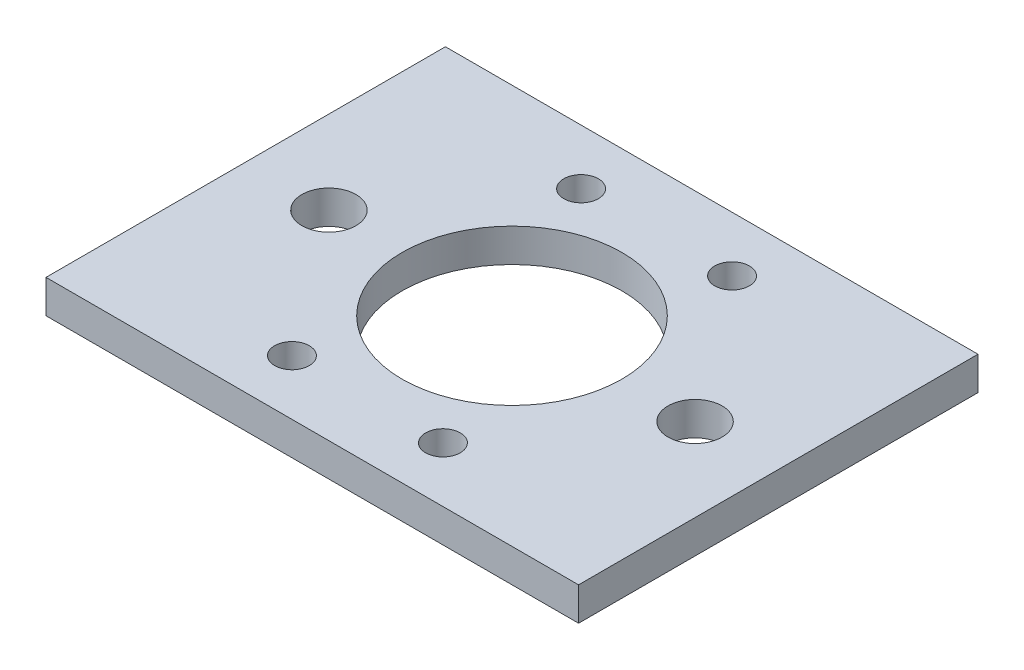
SolidWorks part; units mm, degrees
ref_plane "Front Plane" through (0, 0, 0) normal (0, 0, 1) x (1, 0, 0)
ref_plane "Top Plane" through (0, 0, 0) normal (0, 1, 0) x (1, 0, 0)
ref_plane "Right Plane" through (0, 0, 0) normal (1, 0, 0) x (0, 0, -1)
sketch "Sketch1" plane through (0, 0, 0) normal (0, 1, 0) x (1, 0, 0)
  line L1 (0, 0) -> (-203.2, 0)
  line L2 (0, 0) -> (0, -152.4)
  line L3 (0, -152.4) -> (-203.2, -152.4)
  line L4 (-203.2, 0) -> (-203.2, -152.4)
  dimension "D1" = 152.4
  dimension "D2" = 203.2
extrude "Extrude1" add sketch "Sketch1" along normal blind 12.7
sketch "Sketch2" plane through (0, 12.7, 0) normal (0, 1, 0) x (1, 0, 0)
  line L0 (0, -152.4) -> (0, 0) construction
  line L1 (0, 0) -> (-203.2, 0) construction
  circle A0 centre (-101.6, -76.2) radius 41.91
  dimension "D1" = 83.82
  dimension "D2" = 101.6
  dimension "D3" = 76.2
extrude "Cut-Extrude1" cut sketch "Sketch2" against normal blind 12.7
ref_point "Point1"
sketch "Sketch3" plane through (0, 12.7, 0) normal (0, 1, 0) x (1, 0, 0)
  line L0 (-72.7964, -131.3561) -> (-72.7964, -21.0439)
  line L1 (-72.7964, -76.2) -> (-130.4036, -76.2)
  line L2 (-101.6, -131.3561) -> (-101.6, -21.0439)
  line L3 (-72.7964, -21.0439) -> (-130.4036, -21.0439)
  line L4 (-130.4036, -131.3561) -> (-130.4036, -21.0439)
  line L5 (-72.7964, -131.3561) -> (-130.4036, -131.3561)
  point P10 (-101.6, -76.2)
  dimension "D1" = 28.8036
  dimension "D2" = 55.1561
sketch "Sketch4" plane through (0, 12.7, 0) normal (0, 1, 0) x (1, 0, 0)
  circle A0 centre (-72.7964, -21.0439) radius 6.604
  dimension "D1" = 13.208
extrude "Cut-Extrude2" cut sketch "Sketch4" against normal blind 12.7
sketch "Sketch5" plane through (0, 12.7, 0) normal (0, 1, 0) x (1, 0, 0)
  circle A0 centre (-72.7964, -131.3561) radius 6.604
  circle A1 centre (-130.4036, -21.0439) radius 6.604
  circle A2 centre (-130.4036, -131.3561) radius 6.604
  dimension "D1" = 13.208
extrude "Cut-Extrude3" cut sketch "Sketch5" against normal blind 12.7
sketch "Sketch6" plane through (0, 12.7, 0) normal (0, 1, 0) x (1, 0, 0)
  line L0 (0, -152.4) -> (0, 0) construction
  line L1 (0, 0) -> (-203.2, 0) construction
  circle A0 centre (-31.75, -76.2) radius 10.3188
  circle A1 centre (-171.45, -76.2) radius 10.3187
  dimension "D1" = 20.6375
  dimension "D2" = 20.6375
  dimension "D3" = 31.75
  dimension "D4" = 171.45
  dimension "D5" = 76.2
extrude "Cut-Extrude4" cut sketch "Sketch6" against normal blind 12.7
